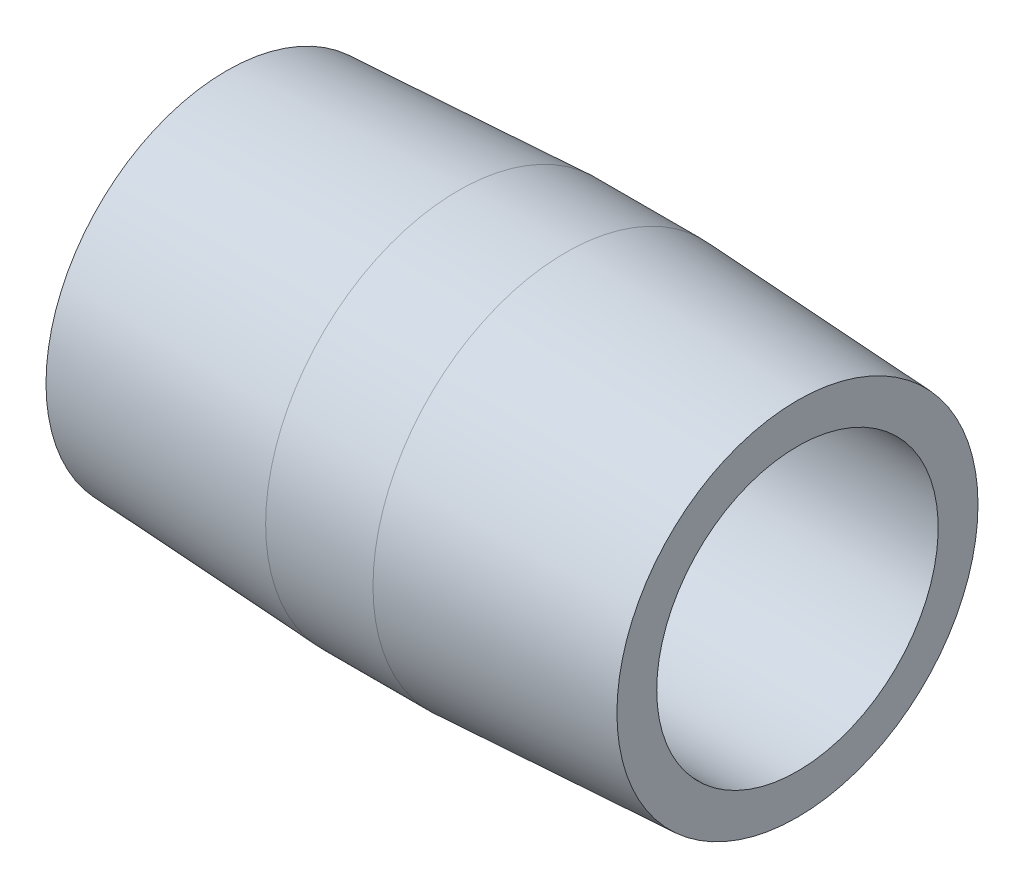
SolidWorks part; units mm, degrees
ref_plane "Front Plane" through (0, 0, 0) normal (0, 0, 1) x (1, 0, 0)
ref_plane "Top Plane" through (0, 0, 0) normal (0, 1, 0) x (1, 0, 0)
ref_plane "Right Plane" through (0, 0, 0) normal (1, 0, 0) x (0, 0, -1)
sketch "Sketch1" plane through (0, 0, 0) normal (0, 0, 1) x (1, 0, 0)
  line L5 (25.4, 6.2611) -> (0, 6.2611)
  line L6 (15.0876, 8.5725) -> (10.3124, 8.5725)
  line L7 (10.3124, 8.5725) -> (0, 8.0321)
  line L8 (25.4, 8.0321) -> (15.0876, 8.5725)
  line L9 (25.4, 6.2611) -> (25.4, 8.0321)
  line L10 (0, 6.2611) -> (0, 8.0321)
  line L11 (0, 0) -> (50000, 0) construction
  line L12 (0, -55) -> (0, 55) construction
  dimension "D1" = 12.5222
  dimension "D2" = 17.145
  dimension "D3" = 3
  dimension "D4" = 3
  dimension "D5" = 25.4
  dimension "D6" = 10.3124
  dimension "D7" = 10.3124
revolve "Revolve1" add sketch "Sketch1" angle 360 about L11
